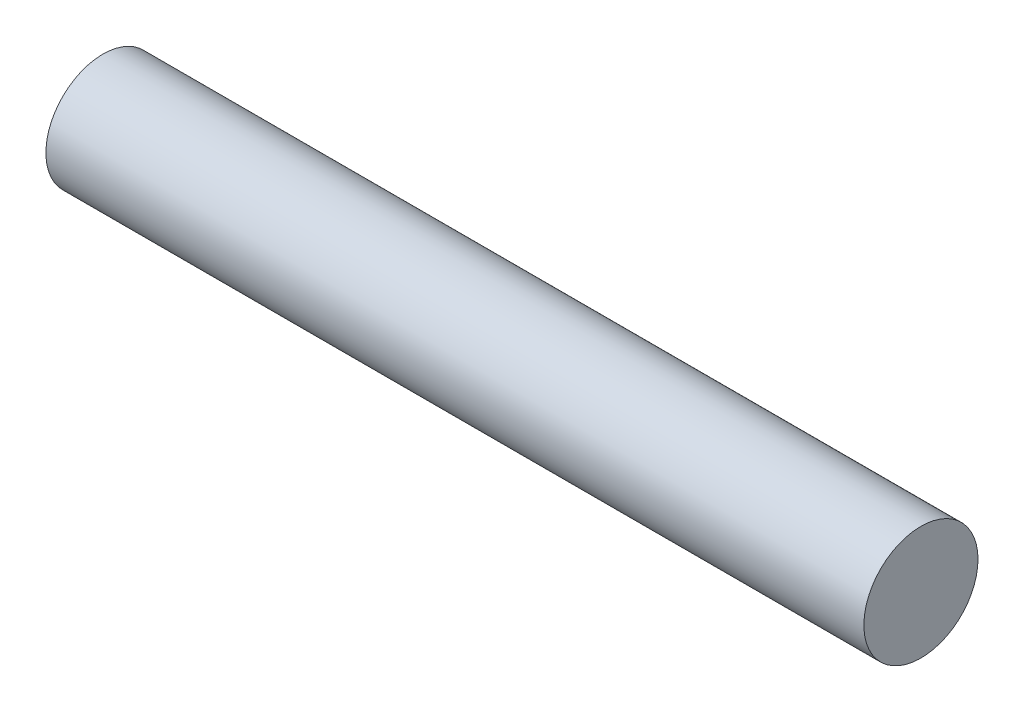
SolidWorks part; units mm, degrees
ref_plane "Plan de face" through (0, 0, 0) normal (0, 0, 1) x (1, 0, 0)
ref_plane "Plan de dessus" through (0, 0, 0) normal (0, 1, 0) x (1, 0, 0)
ref_plane "Plan de droite" through (0, 0, 0) normal (1, 0, 0) x (0, 0, -1)
sketch "Esquisse1" plane through (0, 0, 0) normal (1, 0, 0) x (0, 0, -1)
  circle A0 centre (0, 0) radius 12
  dimension "D1" = 24
extrude "Extrusion1" add sketch "Esquisse1" along normal blind 172
